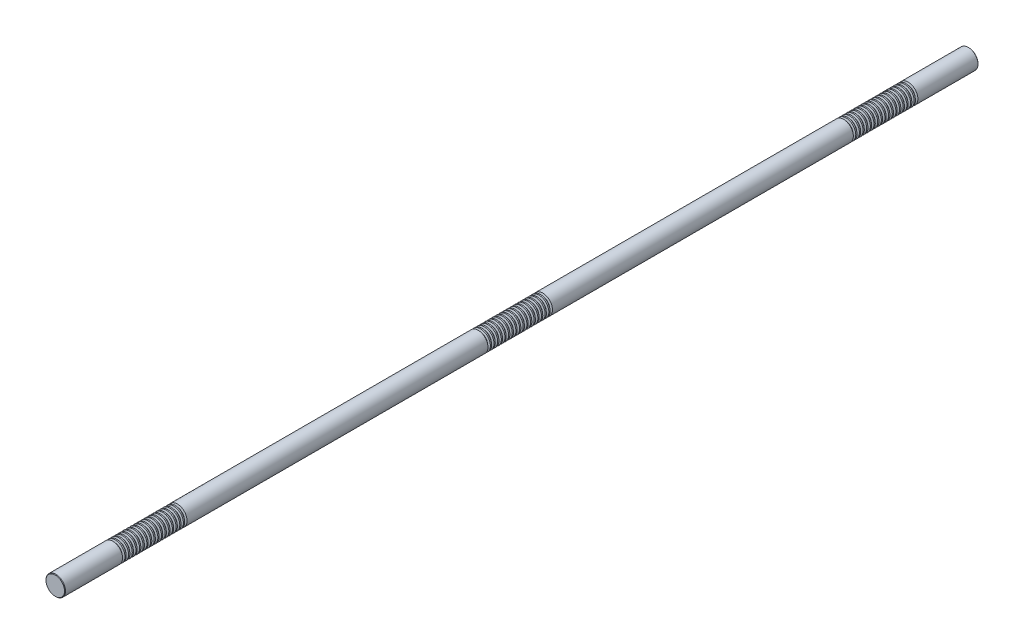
SolidWorks part; units mm, degrees
ref_plane "Front Plane" through (0, 0, 0) normal (0, 0, 1) x (1, 0, 0)
ref_plane "Top Plane" through (0, 0, 0) normal (0, 1, 0) x (1, 0, 0)
ref_plane "Right Plane" through (0, 0, 0) normal (1, 0, 0) x (0, 0, -1)
sketch "Sketch1" plane through (0, 0, 0) normal (0, 0, 1) x (1, 0, 0)
  circle A0 centre (0, 0) radius 16
  dimension "D1" = 32
extrude "Boss-Extrude1" add sketch "Sketch1" along normal mid plane 1500
chamfer "Chamfer1" distance 0.8 angle 45 2 edges at (16, 0, -750) (16, 0, 750)
sketch "Sketch2" plane through (0, 0, 0) normal (1, 0, 0) x (0, 0, -1)
  line L0 (650.4689, 16) -> (646.5311, 16)
  line L1 (749.2, 16) -> (-749.2, 16) construction
  line L2 (646.5311, 16) -> (647.4689, 12.5)
  line L3 (647.4689, 12.5) -> (649.5311, 12.5)
  line L4 (649.5311, 12.5) -> (650.4689, 16)
  line L5 (750, -15.2) -> (750, 15.2) construction
  point P4 (648.5, 16)
  point P7 (648.5, 12.5)
  point P8 (650, 14.25)
  point P9 (647, 14.25)
  dimension "D1" = 3
  dimension "D2" = 100
  dimension "D3" = 3.5
  dimension "D4" = 30
revolve "Cut-Revolve1" cut sketch "Sketch2" angle 360 about axis through (0, 0, 750) along (0, 0, -1)
pattern_linear "LPattern1" count 18 spacing 6 along (0, 0, 1) of "Cut-Revolve1"
pattern_linear "LPattern2" count 3 spacing 600 along (0, 0, 1) of "Cut-Revolve1", "LPattern1"
